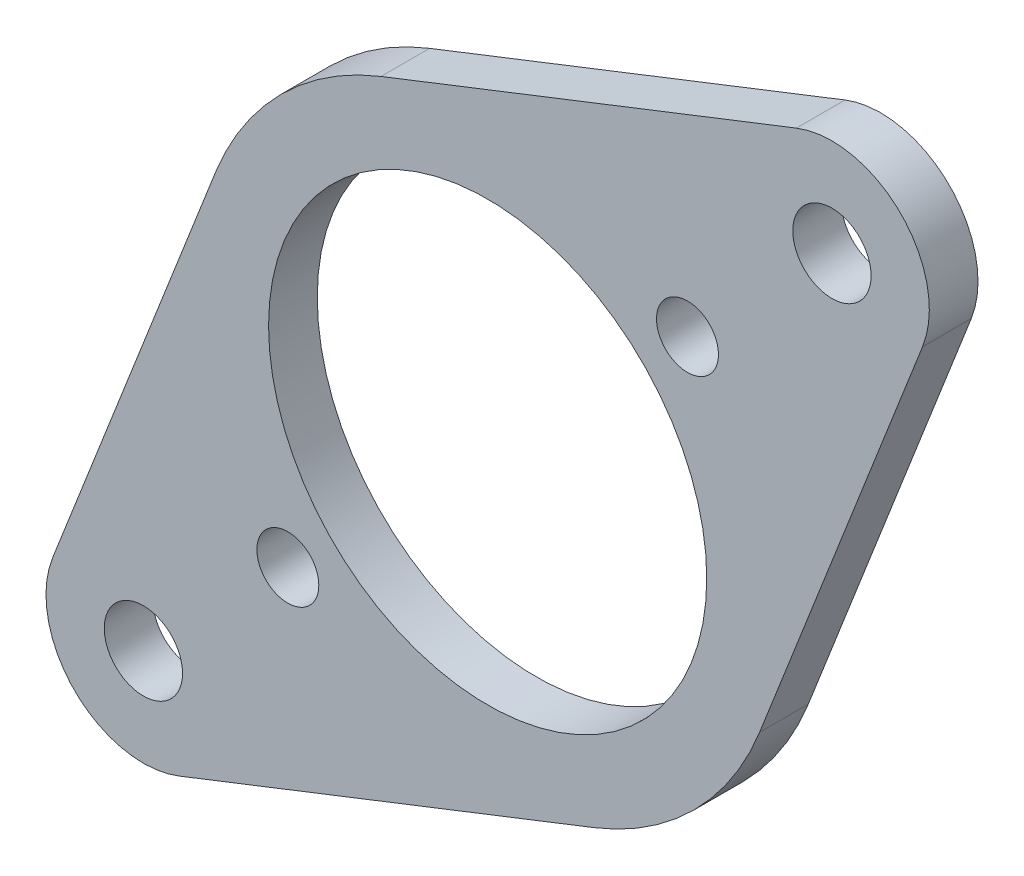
SolidWorks part; units mm, degrees
ref_plane "Front Plane" through (0, 0, 0) normal (0, 0, 1) x (1, 0, 0)
ref_plane "Top Plane" through (0, 0, 0) normal (0, 1, 0) x (1, 0, 0)
ref_plane "Right Plane" through (0, 0, 0) normal (1, 0, 0) x (0, 0, -1)
sketch "Sketch1" plane through (0, 0, 0) normal (0, 0, 1) x (1, 0, 0)
  line L0 (22.4506, 22.4506) -> (-22.4506, -22.4506) construction
  line L1 (0, 0) -> (14.2875, 0) construction
  line L2 (13.0304, 13.0304) -> (-13.0304, -13.0304) construction
  line L3 (-6.9577, 17.734) -> (20.1314, 28.362)
  line L4 (28.362, 20.1314) -> (17.734, -6.9577)
  line L5 (-20.1314, -28.362) -> (6.9577, -17.734)
  line L6 (-17.734, 6.9577) -> (-28.362, -20.1314)
  circle A0 centre (0, 0) radius 14.2875
  circle A1 centre (0, 0) radius 15.875 construction
  circle A2 centre (22.4506, 22.4506) radius 2.5527
  circle A3 centre (-22.4506, -22.4506) radius 2.5527
  circle A4 centre (-13.0304, -13.0304) radius 2.0193
  circle A5 centre (13.0304, 13.0304) radius 2.0193
  circle A6 centre (13.0304, 13.0304) radius 2.5527 construction
  arc A7 (28.362, 20.1314) -> (20.1314, 28.362) centre (22.4506, 22.4506) ccw
  arc A8 (-28.362, -20.1314) -> (-20.1314, -28.362) centre (-22.4506, -22.4506) ccw
  arc A9 (-6.9577, 17.734) -> (-17.734, 6.9577) centre (0, 0) ccw
  arc A10 (6.9577, -17.734) -> (17.734, -6.9577) centre (0, 0) ccw
  dimension "D1" = 28.575
  dimension "D3" = 5.1054
  dimension "D6" = 4.0386
  dimension "D7" = 5.1054
  dimension "D9" = 12.7
  dimension "D10" = 38.1
  dimension "D4" = 45
  dimension "D5" = 31.75
  dimension "D8" = 135
  dimension "D2" = 1.5875
extrude "Boss-Extrude1" add sketch "Sketch1" along normal blind 3.175
ref_plane "Plane1" through (-1.805, 1.805, 0) normal (0.7071, -0.7071, 0) x (-0.7071, -0.7071, 0)
